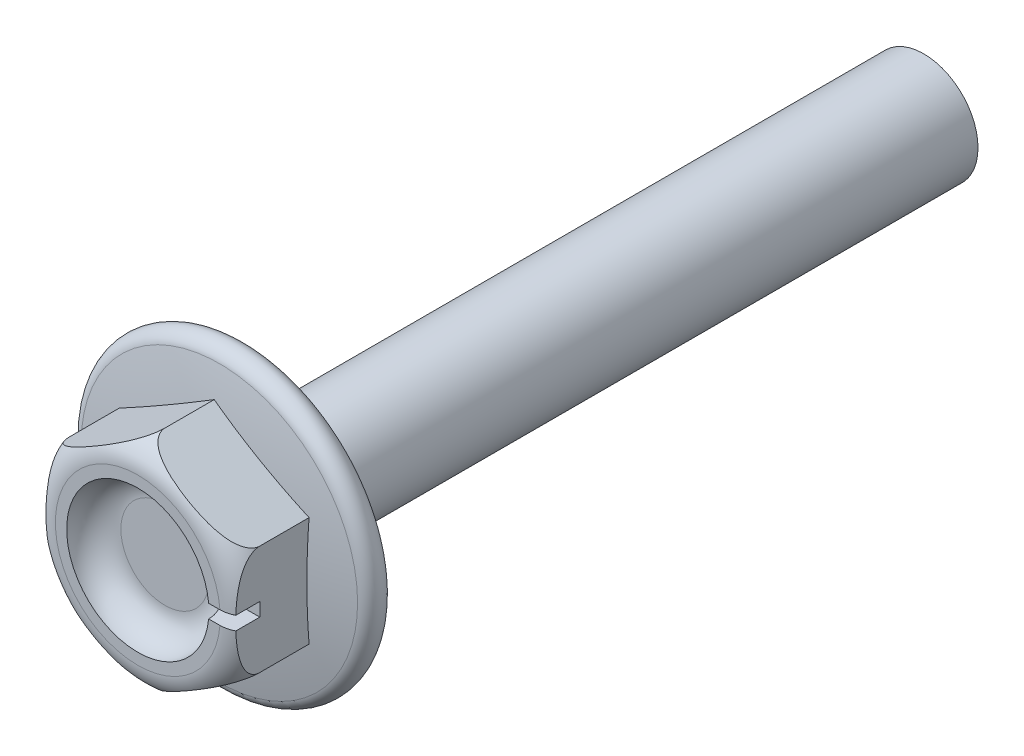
SolidWorks part; units mm, degrees
extrude "Shank" add sketch "Shank Sketch" against normal blind 25
sketch "Shank Sketch" plane through (0, 0, 0) normal (0, 0, 1) x (1, 0, 0)
  line L0 (50, 0) -> (-50, 0) construction
  line L1 (0, -50) -> (0, 50) construction
  circle A0 centre (0, 0) radius 2
  dimension "Shank diameter" = 4
extrude "Head" add sketch "Head Sketch" along normal blind 4
sketch "Head Sketch" plane through (0, 0, 0) normal (0, 0, 1) x (1, 0, 0)
  line L0 (0, 4.0415) -> (3.5, 2.0207)
  line L1 (3.5, 2.0207) -> (3.5, -2.0207)
  line L2 (3.5, -2.0207) -> (0, -4.0415)
  line L3 (0, -4.0415) -> (-3.5, -2.0207)
  line L4 (-3.5, -2.0207) -> (-3.5, 2.0207)
  line L5 (-3.5, 2.0207) -> (0, 4.0415)
  line L6 (3.5, 2.0207) -> (-3.5, -2.0207) construction
  line L7 (0, 4.0415) -> (0, -4.0415) construction
  line L8 (-3.5, 2.0207) -> (3.5, -2.0207) construction
  point P0 (0, 0)
  dimension "D1" = 60
  dimension "D2" = 60
  dimension "Width across flats" = 7
ref_plane "Plane1" through (0, 0, 0) normal (0, 0, 1) x (1, 0, 0)
ref_plane "Plane2" through (0, 0, 0) normal (0, 1, 0) x (-1, 0, 0)
ref_plane "Plane3" through (0, 0, 0) normal (1, 0, 0) x (0, 0, -1)
sketch "Sketch3" plane through (0, 0, 0) normal (0, 1, 0) x (-1, 0, 0)
  line L0 (0, 0) -> (0, 3) construction
  line L1 (0, -25) -> (0, 0) construction
  line L4 (-5, 0) -> (0, 0)
  line L5 (0, 0) -> (0, 1.5)
  arc A0 (0, 1.5) -> (-5.099, 0.9901) centre (0, -24.25) ccw
  arc A1 (-5, 0) -> (-5.099, 0.9901) centre (-5, 0.5) cw
  dimension "D1" = 0.5
  dimension "D2" = 10
  dimension "D3" = 1.5
revolve "Flange" add sketch "Sketch3" angle 360 about L0
sketch "Sketch5" plane through (0, 0, 0) normal (1, 0, 0) x (0, 0, -1)
  line L0 (-4, -3.0415) -> (-4, -4.0415)
  line L1 (-4, -4.0415) -> (-3, -4.0415)
  line L2 (-4, -4.0415) -> (-1.1809, -4.0415) construction
  line L3 (-4, -4.0415) -> (-4, -2.0207) construction
  line L5 (-15.0856, 0) -> (-8.1394, 0) construction
  line L6 (50, 0) -> (-50, 0) construction
  arc A0 (-4, -3.0415) -> (-3, -4.0415) centre (-3, -3.0415) ccw
  dimension "D1" = 1
revolve "Head Trim" cut sketch "Sketch5" angle 360 about L5
sketch "Sketch6" plane through (0, 0, 4) normal (0, 0, 1) x (1, 0, 0)
  circle A3 centre (0, 0) radius 2.625
extrude "Head Cut" cut sketch "Sketch6" against normal blind 1
fillet "Fillet1" radius 1 1 edges at (2.625, 0, 3)
sketch "Sketch7" plane through (0.7418, 1.4072, 4) normal (0, 0, 1) x (1, 0, 0)
  line L0 (-0.7418, -1.4072) -> (2.7582, -1.4072) construction
  line L2 (-0.7418, -1.1572) -> (-0.7418, -1.6572)
  line L3 (-0.7418, -1.6572) -> (2.7582, -1.6572)
  line L5 (-0.7418, -1.1572) -> (2.7582, -1.1572)
  line L6 (2.7582, -1.6572) -> (2.7582, -1.1572)
  line L8 (2.7582, -3.4279) -> (2.7582, 0.6135) construction
  circle A1 centre (-0.7418, -1.4072) radius 1.625 construction
  dimension "D1" = 0.5
extrude "Cut-Extrude1" cut sketch "Sketch7" against normal blind 1
equation "\"D1@Sketch6\" = \"Width across flats@Head Sketch\"*3/4"
